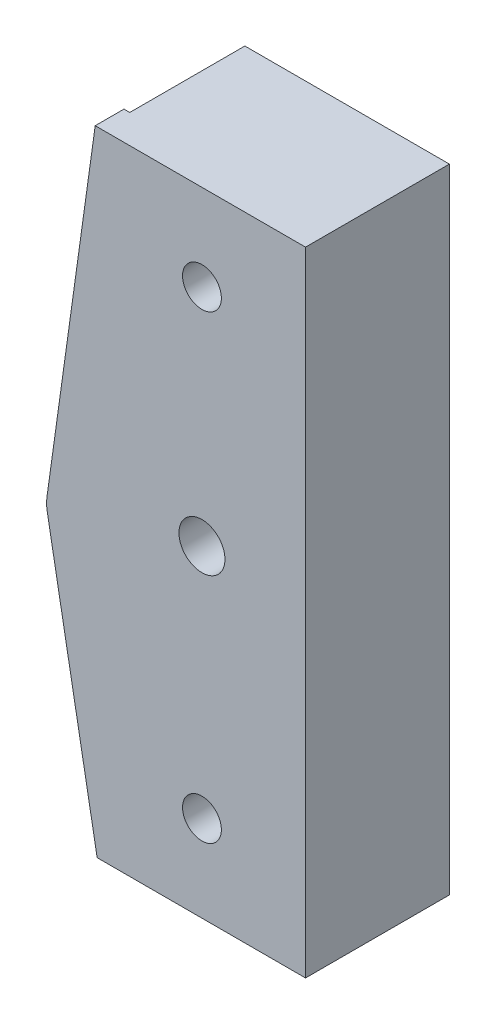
SolidWorks part; units mm, degrees
ref_plane "Frontal" through (0, 0, 0) normal (0, 0, 1) x (1, 0, 0)
ref_plane "Horizontal" through (0, 0, 0) normal (0, 1, 0) x (1, 0, 0)
ref_plane "Profil" through (0, 0, 0) normal (1, 0, 0) x (0, 0, -1)
sketch "Esquisse1" plane through (0, 0, 0) normal (0, 0, 1) x (1, 0, 0)
  line L0 (63.3076, 149.3296) -> (56.0672, 97.4679) construction
  line L1 (64.4483, 157.5) -> (56.0672, 97.4679)
  line L2 (56.1127, 95.2489) -> (63.3466, 55.4276) construction
  line L3 (56.1127, 95.2489) -> (64.7867, 47.5)
  line L4 (0, 47.5) -> (101, 47.5) construction
  line L5 (64.7867, 47.5) -> (101, 47.5)
  line L6 (101, 157.5) -> (0, 157.5) construction
  line L7 (101, 157.5) -> (64.4483, 157.5)
  line L8 (101, 157.5) -> (101, 47.5)
  arc A0 (56.0672, 97.4679) -> (56.1127, 95.2489) centre (63, 96.5) ccw construction
  arc A1 (56.0672, 97.4679) -> (56.1127, 95.2489) centre (63, 96.5) ccw
extrude "Base-Extrusion" add sketch "Esquisse1" along normal blind 25
sketch "Esquisse6" plane through (0, 0, 0) normal (0, 0, -1) x (-1, 0, 0)
  line L4 (-57.0966, 95.4276) -> (-65.7706, 47.6787)
  line L5 (-65.4387, 157.3617) -> (-57.0576, 97.3296)
  line L6 (-57.0966, 95.4276) -> (-68.0632, 35.0585)
  line L7 (-67.0713, 169.056) -> (-57.0576, 97.3296)
  arc A2 (-57.0966, 95.4276) -> (-57.0576, 97.3296) centre (-63, 96.5) ccw
  arc A3 (-57.0966, 95.4276) -> (-57.0576, 97.3296) centre (-63, 96.5) ccw
  dimension "D1" = 1
extrude "Enlèv. de mat.-Extru.-Mince1" cut sketch "Esquisse6" against normal blind 20 thin
sketch "Esquisse7" plane through (0, 0, 0) normal (0, 0, -1) x (-1, 0, 0)
  line L0 (-101, 47.5) -> (-101, 157.5) construction
  line L1 (-101, 157.5) -> (-64.4483, 157.5) construction
  line L2 (-101, 157.5) -> (-65.458, 157.5) construction
  line L3 (-65.8031, 47.5) -> (-101, 47.5) construction
  circle A0 centre (-83, 142.5) radius 3.375
  circle A1 centre (-83, 103.5) radius 4
  circle A2 centre (-83, 62.5) radius 3.375
  dimension "D1" = 6.75
  dimension "D2" = 8
  dimension "D3" = 18
  dimension "D4" = 15
  dimension "D5" = 15
  dimension "D6" = 56
extrude "Enlèv. mat.-Extru.1" cut sketch "Esquisse7" against normal through all
